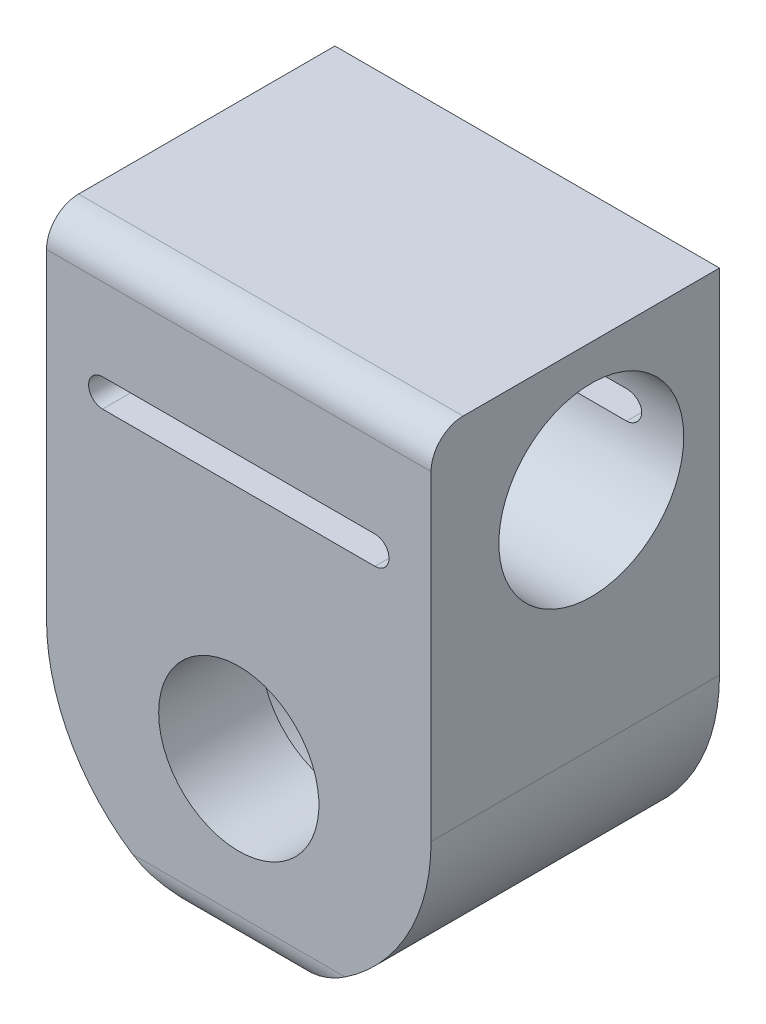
SolidWorks part; units mm, degrees
ref_plane "Front Plane" through (0, 0, 0) normal (0, 0, 1) x (1, 0, 0)
ref_plane "Top Plane" through (0, 0, 0) normal (0, 1, 0) x (1, 0, 0)
ref_plane "Right Plane" through (0, 0, 0) normal (1, 0, 0) x (0, 0, -1)
sketch "Sketch1" plane through (0, 0, 0) normal (0, 0, 1) x (1, 0, 0)
  line L1 (-76.2, -139.7) -> (76.2, -139.7)
  line L2 (-76.2, -139.7) -> (-76.2, 76.2)
  line L3 (-76.2, 76.2) -> (76.2, 76.2)
  line L4 (76.2, -139.7) -> (76.2, 76.2)
  dimension "D1" = 152.4
  dimension "D2" = 215.9
  dimension "D3" = 139.7
  dimension "D4" = 76.2
extrude "Extrude1" add sketch "Sketch1" along normal blind 114.3
sketch "Sketch3" plane through (76.2, 0, 0) normal (1, 0, 0) x (0, 0, -1)
  line L0 (0, -139.7) -> (0, 76.2) construction
  circle A0 centre (-50.8, 25.4) radius 36.6395
  dimension "D1" = 73.279
  dimension "D2" = 25.4
  dimension "D3" = 50.8
extrude "Cut-Extrude1" cut sketch "Sketch3" against normal through all
sketch "Sketch4" plane through (0, 0, 0) normal (0, 0, -1) x (-1, 0, 0)
  line L0 (76.2, 25.4) -> (-76.2, 25.4) construction
  circle A0 centre (0, -73.152) radius 31.75
  dimension "D1" = 63.5
  dimension "D2" = 98.552
extrude "Cut-Extrude2" cut sketch "Sketch4" against normal through all
sketch "Sketch8" plane through (0, 0, 0) normal (0, 0, -1) x (-1, 0, 0)
  circle A0 centre (0, -73.152) radius 55.0545
  dimension "D1" = 110.109
extrude "Cut-Extrude5" cut sketch "Sketch8" against normal blind 73.66
fillet "Fillet1" radius 12.7 1 edges at (0, 76.2, 114.3)
fillet "Fillet2" radius 12.7 1 edges at (0, -139.7, 114.3)
fillet "Fillet4" radius 76.2 2 edges at (-76.2, -139.7, 50.8) (-76.2, -135.9803, 110.5803)
fillet "Fillet5" radius 76.2 4 edges at (76.2, -139.7, 50.8) (76.2, -135.9803, 110.5803) (38.1, -139.7, 101.6) (38.1, -139.7, 0)
sketch "Sketch9" plane through (0, 0, 114.3) normal (0, 0, 1) x (1, 0, 0)
  line L0 (-76.2, 25.4) -> (76.2, 25.4) construction
  line L1 (-53.975, 19.8501) -> (53.975, 19.8501)
  line L2 (53.975, 30.9499) -> (-53.975, 30.9499)
  arc A0 (-53.975, 30.9499) -> (-53.975, 19.8501) centre (-53.975, 25.4) ccw
  arc A1 (53.975, 19.8501) -> (53.975, 30.9499) centre (53.975, 25.4) ccw
  dimension "D1" = 11.0998
  dimension "D2" = 53.975
  dimension "D3" = 53.975
extrude "Cut-Extrude6" cut sketch "Sketch9" against normal through all
